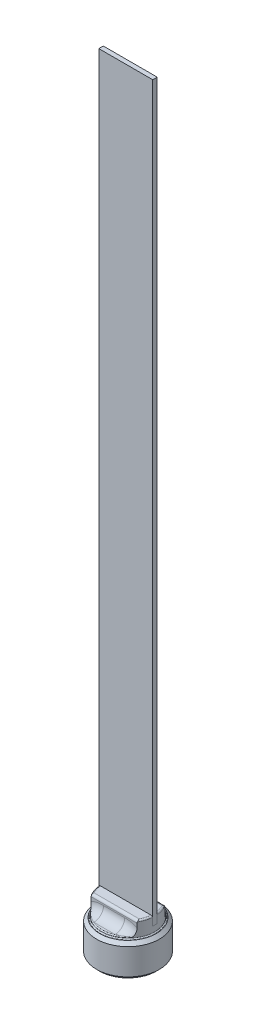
SolidWorks part; units mm, degrees
ref_plane "Front Plane" through (0, 0, 0) normal (0, 0, 1) x (1, 0, 0)
ref_plane "Top Plane" through (0, 0, 0) normal (0, 1, 0) x (1, 0, 0)
ref_plane "Right Plane" through (0, 0, 0) normal (1, 0, 0) x (0, 0, -1)
imported_body "Imported1"
sketch "Sketch1" plane through (0, 20.828, 0) normal (0, 1, 0) x (1, 0, 0)
  line L0 (14.0347, 1.1811) -> (-14.0347, 1.1811) construction
  line L1 (14.1749, 1.1811) -> (-14.1749, 1.1811)
  line L3 (14.1749, -1.1811) -> (-14.1749, -1.1811)
  line L5 (0, -1.1811) -> (0, 1.1811) construction
  line L6 (14.224, 0) -> (-14.224, 0) construction
  line L7 (-14.0347, -1.1811) -> (14.0347, -1.1811) construction
  arc A0 (-14.1749, 1.1811) -> (-14.1749, -1.1811) centre (0, 0) ccw
  arc A1 (14.1749, -1.1811) -> (14.1749, 1.1811) centre (0, 0) ccw
  dimension "D1" = 28.448
extrude "Boss-Extrude1" add sketch "Sketch1" along normal offset from surface (385.572 mm away) 406.4
